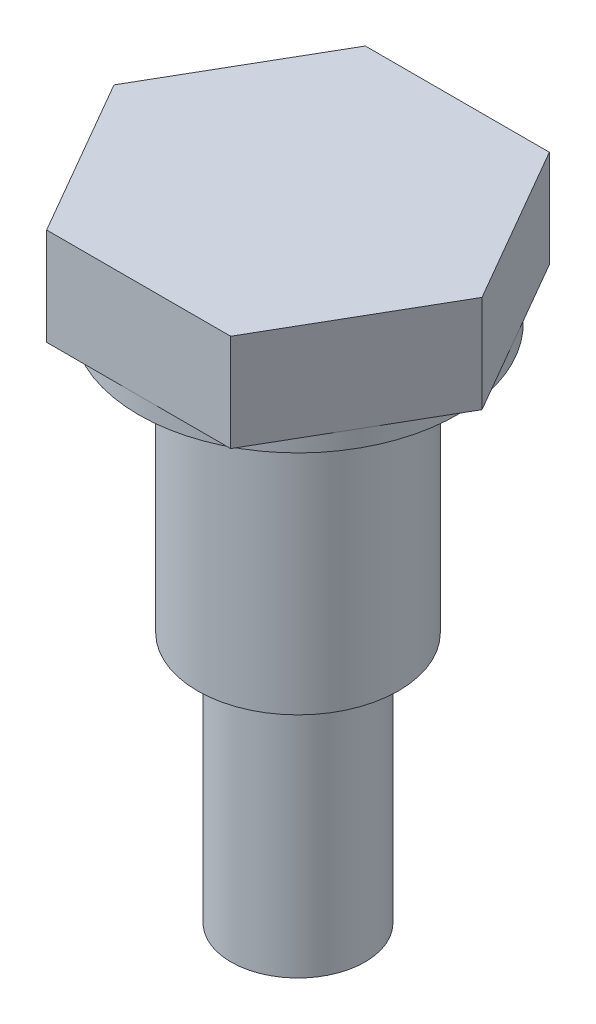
SolidWorks part; units mm, degrees
ref_plane "Front" through (0, 0, 0) normal (0, 0, 1) x (1, 0, 0)
ref_plane "Top" through (0, 0, 0) normal (0, 1, 0) x (1, 0, 0)
ref_plane "Right" through (0, 0, 0) normal (1, 0, 0) x (0, 0, -1)
sketch "Sketch1" plane through (0, 0, 0) normal (0, 1, 0) x (1, 0, 0)
  circle A0 centre (0, 0) radius 4
  dimension "D1" = 8
extrude "Extrude1" add sketch "Sketch1" along normal blind 15
sketch "Sketch2" plane through (0, 15, 0) normal (0, 1, 0) x (1, 0, 0)
  circle A0 centre (0, 0) radius 6
  dimension "D1" = 12
extrude "Extrude2" add sketch "Sketch2" along normal blind 16
sketch "Sketch3" plane through (0, 31, 0) normal (0, 1, 0) x (1, 0, 0)
  circle A0 centre (0, 0) radius 9.5
  dimension "D1" = 19
extrude "Extrude3" add sketch "Sketch3" along normal blind 1
sketch "Sketch4" plane through (0, 32, 0) normal (0, 1, 0) x (1, 0, 0)
  line L0 (-5.4848, 9.5) -> (5.4848, 9.5)
  line L1 (5.4848, 9.5) -> (10.9697, 0)
  line L2 (10.9697, 0) -> (5.4848, -9.5)
  line L3 (5.4848, -9.5) -> (-5.4848, -9.5)
  line L4 (-5.4848, -9.5) -> (-10.9697, 0)
  line L5 (-10.9697, 0) -> (-5.4848, 9.5)
  circle A0 centre (0, 0) radius 9.5 construction
  dimension "D1" = 120
  dimension "D2" = 120
  dimension "D3" = 120
  dimension "D4" = 120
  dimension "D5" = 120
extrude "Extrude4" add sketch "Sketch4" along normal blind 5.8
